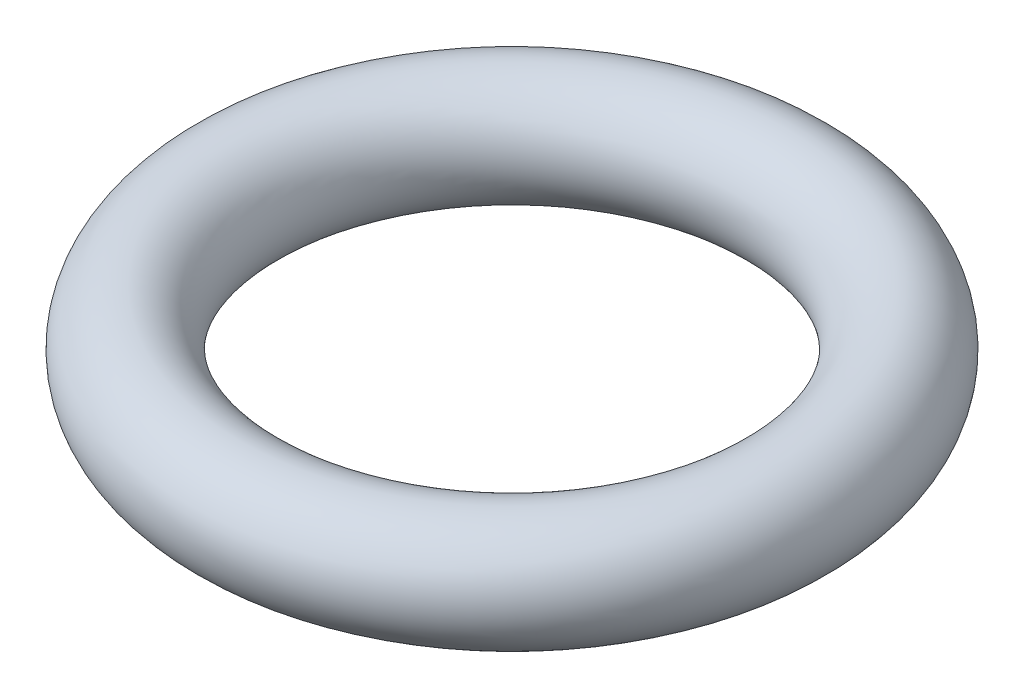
SolidWorks part; units mm, degrees
ref_plane "Plan1" through (0, 0, 0) normal (0, 0, 1) x (1, 0, 0)
ref_plane "Plan2" through (0, 0, 0) normal (0, 1, 0) x (1, 0, 0)
ref_plane "Plan3" through (0, 0, 0) normal (1, 0, 0) x (0, 0, -1)
sketch "Esquisse1" plane through (0, 0, 0) normal (0, 0, 1) x (1, 0, 0)
  line L0 (0, 40) -> (0, -50) construction
  line L1 (-70, 0) -> (70, 0) construction
  line L2 (-4.15, 30) -> (-4.15, -40) construction
  circle A0 centre (-4.15, 0) radius 0.85
  dimension "D2" = 1.7
  dimension "D1" = 4.15
revolve "Base-Révolution" add sketch "Esquisse1" angle 360 about L0
